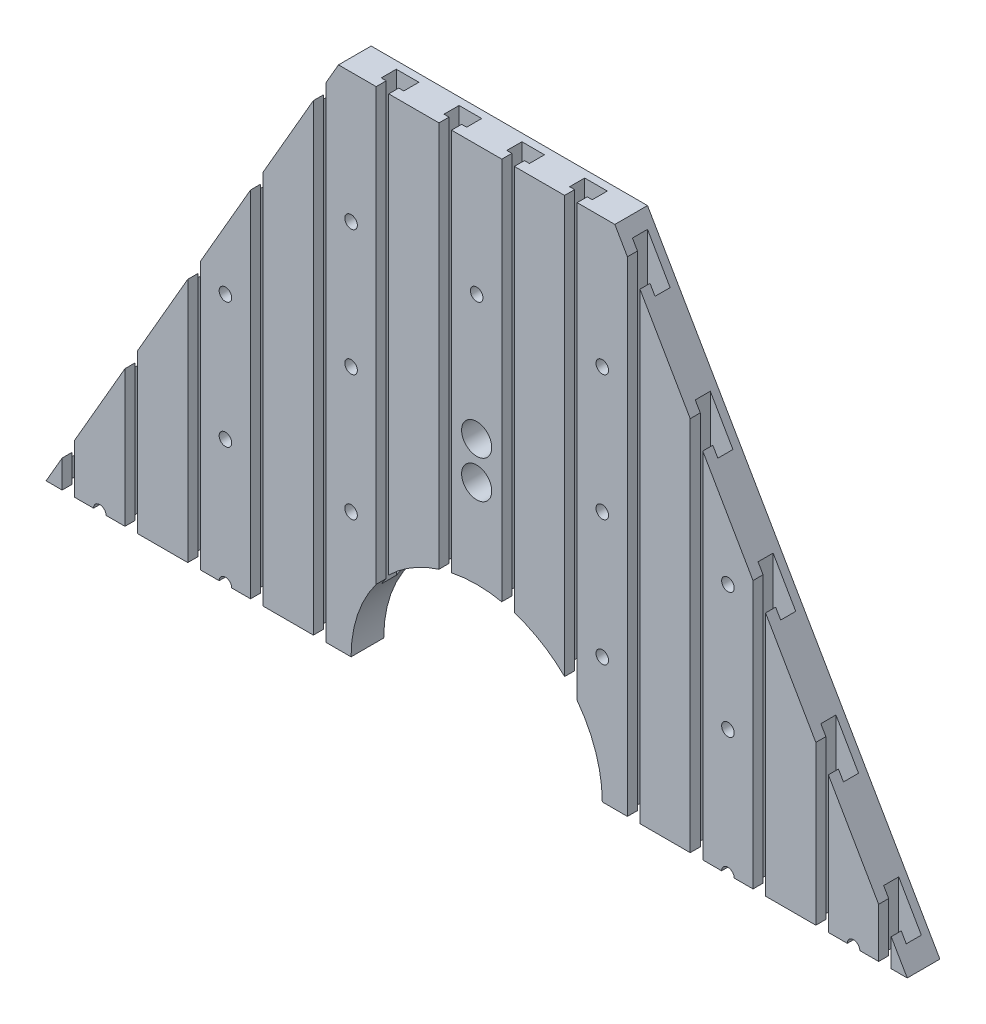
SolidWorks part; units mm, degrees
ref_plane "Plan de face" through (0, 0, 0) normal (0, 0, 1) x (1, 0, 0)
ref_plane "Plan de dessus" through (0, 0, 0) normal (0, 1, 0) x (1, 0, 0)
ref_plane "Plan de droite" through (0, 0, 0) normal (1, 0, 0) x (0, 0, -1)
sketch "Esquisse1" plane through (0, 0, 0) normal (0, 0, 1) x (1, 0, 0)
  line L6 (35.7636, 358.7862) -> (-423.8647, -437.3133) construction
  line L7 (-755.4678, -148.4209) -> (879.7592, -148.4209) construction
  line L8 (-46.1325, 376.7457) -> (415.4529, -422.7436) construction
  line L9 (257.0726, -148.4209) -> (-245.0999, 141.5085) construction
  line L10 (-257.0726, -148.4209) -> (263.2247, 151.9729) construction
  line L11 (-55, 201.5791) -> (55, 201.5791)
  line L12 (-147.0726, -148.4209) -> (147.0726, -148.4209)
  line L13 (147.0726, -148.4209) -> (202.0726, -53.1581)
  line L14 (202.0726, -53.1581) -> (55, 201.5791)
  line L15 (-147.0726, -148.4209) -> (-202.0726, -53.1581)
  line L16 (-202.0726, -53.1581) -> (-55, 201.5791)
  dimension "D1" = 60
  dimension "D2" = 60
  dimension "D3" = 110
  dimension "D4" = 350
  dimension "D5" = 60
  dimension "D6" = 60
  dimension "D7" = 110
  dimension "D8" = 110
extrude "Boss.-Extru.2" add sketch "Esquisse1" along normal blind 13
sketch "Esquisse3" plane through (0, 201.5791, 0) normal (0, 1, 0) x (1, 0, 0)
  line L0 (-12.5, 6.793) -> (-12.5, -19.2478) construction
  line L1 (-8, -3) -> (-17, -3)
  line L2 (-17, -3) -> (-17, -9)
  line L3 (-17, -9) -> (-15, -9)
  line L4 (-15, -9) -> (-15, -13)
  line L5 (55, -13) -> (-55, -13) construction
  line L6 (-10, -9) -> (-10, -13)
  line L7 (-8, -9) -> (-10, -9)
  line L8 (-8, -3) -> (-8, -9)
  line L9 (-15, -13) -> (-10, -13)
  point P2 (-12.5, -13)
  point P14 (-12.5, -3)
  dimension "D1" = 12.5
  dimension "D2" = 9
  dimension "D3" = 5
  dimension "D4" = 6
  dimension "D5" = 4
extrude "Enlèv. mat.-Extru.1" cut sketch "Esquisse3" against normal up to next
pattern_linear "Répétition linéaire1" count 8 spacing 25 along (1, 0, 0) of "Enlèv. mat.-Extru.1"
pattern_linear "Répétition linéaire2" count 7 spacing 25 along (-1, 0, 0) of "Enlèv. mat.-Extru.1"
sketch "3parties" plane through (0, 0, 0) normal (0, 0, 1) x (1, 0, 0)
  line L2 (-50, 0) -> (-171.3817, 0)
  line L3 (-165, 11.0535) -> (-202.0726, -53.1581) construction
  line L4 (50, 0) -> (171.3817, 0)
  line L5 (202.0726, -53.1581) -> (165, 11.0535) construction
  line L6 (0, -50) -> (0, -148.4209)
  line L7 (-10, -148.4209) -> (10, -148.4209) construction
  circle A0 centre (0, 0) radius 50
  dimension "D1" = 100
sketch "certcleRotules" plane through (0, 0, 13) normal (0, 0, 1) x (1, 0, 0)
  circle A0 centre (0, 0) radius 157.5
  dimension "D1" = 315
sketch "Esquisse6" plane through (0, 0, 0) normal (0, 1, 0) x (1, 0, 0)
  line L0 (-157.5, -13) -> (157.5, -13) construction
  line L1 (0, 0) -> (-4.5, 0)
  line L2 (0, 0) -> (0, -13)
  line L3 (-2.5, -9) -> (-4.5, -9)
  line L4 (-4.5, 0) -> (-4.5, -9)
  line L7 (0, -13) -> (-2.5, -13)
  line L8 (-2.5, -9) -> (-2.5, -13)
  dimension "D1" = 4.5
  dimension "D2" = 2.5
  dimension "D3" = 4
revolve "Enlèvement de matière-Révolution1" cut sketch "Esquisse6" angle 360 about L2
pattern_linear "Répétition linéaire3" count 4 spacing 50 along (0, 1, 0) count 4 spacing 50 along (1, 0, 0) of "Enlèvement de matière-Révolution1"
pattern_linear "Répétition linéaire5" count 3 spacing 50 along (0, -1, 0) count 4 spacing 50 along (1, 0, 0) of "Enlèvement de matière-Révolution1"
pattern_linear "Répétition linéaire6" count 4 spacing 50 along (0, 1, 0) count 4 spacing 50 along (-1, 0, 0) of "Enlèvement de matière-Révolution1"
pattern_linear "Répétition linéaire7" count 3 spacing 50 along (0, -1, 0) count 4 spacing 50 along (-1, 0, 0) of "Enlèvement de matière-Révolution1"
sketch "Esquisse8" plane through (0, 0, 0) normal (0, 0, -1) x (-1, 0, 0)
  circle A0 centre (0, 100) radius 4.5 construction
  circle A1 centre (0, 100) radius 4.5
extrude "bouchonBarreauHaut" add sketch "Esquisse8" against normal blind 13
sketch "Esquisse7" plane through (0, 0, 0) normal (0, 0, -1) x (-1, 0, 0)
  line L1 (-6.5, 105.15) -> (6.5, 105.15)
  line L2 (-6.5, 105.15) -> (-6.5, 80.15)
  line L3 (-6.5, 80.15) -> (6.5, 80.15)
  line L4 (6.5, 105.15) -> (6.5, 80.15)
  line L5 (0, 7.15) -> (0, -7.15) construction
  dimension "D1" = 25
  dimension "D2" = 80.15
  dimension "D3" = 13
  dimension "D4" = 6.5
extrude "Boss.-Extru.4" add sketch "Esquisse7" along normal blind 5
sketch "Esquisse9" plane through (0, 0, 0) normal (1, 0, 0) x (0, 0, -1)
  line L0 (5, 80.15) -> (0, 80.15) construction
  line L1 (5, 80.15) -> (5, 105.15) construction
  line L3 (5, 85.15) -> (5, 82.5)
  line L4 (5, 82.5) -> (-3, 82.5)
  line L6 (-3, -148.4209) -> (-3, 201.5791) construction
  line L7 (-13, 157.5) -> (-13, -157.5) construction
  line L8 (-3, 79.15) -> (-13, 79.15)
  line L9 (-3, 79.15) -> (-3, 82.5)
  line L10 (5, 85.15) -> (-13, 85.15)
  line L11 (-13, 79.15) -> (-13, 85.15)
  dimension "D1" = 5
  dimension "D2" = 2.65
  dimension "D3" = 6
revolve "Enlèvement de matière-Révolution2" cut sketch "Esquisse9" angle 360 about L10
pattern_linear "Répétition linéaire8" count 2 spacing 15 along (0, 1, 0) of "Enlèvement de matière-Révolution2"
pattern_circular "Répétition circulaire1" count 3 every 120 about axis through (0, 0, 0) along (0, 0, 1) of "Boss.-Extru.4", "Enlèvement de matière-Révolution2", "Répétition linéaire8"
sketch "Esquisse10" plane through (0, 0, 0) normal (1, 0, 0) x (0, 0, -1)
  line L0 (0, 201.5791) -> (0, -53.1581) construction
  line L1 (0, 77.5) -> (5, 77.5)
  line L2 (0, 77.5) -> (0, 72.5)
  line L3 (0, 72.5) -> (5, 72.5)
  line L4 (5, 77.5) -> (5, 72.5)
  line L5 (0, 50) -> (0, -50) construction
  line L6 (0, -72.5) -> (5, -72.5)
  line L7 (0, -72.5) -> (0, -77.5)
  line L8 (0, -77.5) -> (5, -77.5)
  line L9 (5, -72.5) -> (5, -77.5)
  line L10 (5, 80.15) -> (5, 105.15) construction
  line L11 (-9, 50) -> (0, 50) construction
  line L13 (-9, -100) -> (0, -100) construction
  point P16 (2.5, 72.5)
  point P19 (2.5, -72.5)
  dimension "D1" = 22.5
  dimension "D2" = 5
  dimension "D3" = 22.5
  dimension "D4" = 5
extrude "Boss.-Extru.6" add sketch "Esquisse10" along normal mid plane 215
chamfer "Chanfrein1" distance 5 angle 60 4 edges at (107.5, -75, -5) (-107.5, -75, -5) (-107.5, 75, -5) (107.5, 75, -5)
sketch "Esquisse11" plane through (0, 0, 13) normal (0, 0, 1) x (1, 0, 0)
  line L0 (-10, -148.4209) -> (-10, 201.5791) construction
  line L1 (-10, 23.5) -> (10, 23.5)
  line L2 (-10, 23.5) -> (-10, -23.5)
  line L3 (-10, -23.5) -> (10, -23.5)
  line L4 (10, 23.5) -> (10, -23.5)
  line L5 (10, -148.4209) -> (10, 201.5791) construction
  dimension "D1" = 47
  dimension "D2" = 23.5
extrude "Enlèv. mat.-Extru.2" cut sketch "Esquisse11" against normal blind 8.9
sketch "Esquisse13" plane through (-8, 0, 0) normal (-1, 0, 0) x (0, 0, 1)
  line L1 (4.1, -23.5) -> (11.1, -23.5)
  line L2 (4.1, -23.5) -> (4.1, -40)
  line L3 (4.1, -40) -> (6.1, -40)
  line L4 (11.1, -23.5) -> (11.1, -35)
  arc A0 (6.1, -40) -> (11.1, -35) centre (6.1, -35) ccw
  dimension "D2" = 5
  dimension "D1" = 16.5
  dimension "D3" = 7
extrude "Enlèv. mat.-Extru.3" cut sketch "Esquisse13" against normal up to surface (16 mm away)
sketch "Esquisse14" plane through (0, 0, 4.1) normal (0, 0, 1) x (1, 0, 0)
  line L0 (-8, 23.5) -> (-8, -40) construction
  line L1 (-3, -20) -> (3, -20)
  line L2 (-8, -25) -> (-8, -35)
  line L3 (-3, -40) -> (3, -40)
  line L4 (8, -25) -> (8, -35)
  line L5 (8, -40) -> (8, 23.5) construction
  line L6 (8, -40) -> (-8, -40) construction
  arc A0 (-8, -35) -> (-3, -40) centre (-3, -35) ccw
  arc A1 (3, -40) -> (8, -35) centre (3, -35) ccw
  arc A2 (3, -20) -> (8, -25) centre (3, -25) cw
  arc A3 (-3, -20) -> (-8, -25) centre (-3, -25) ccw
  point P16 (8, -20)
  point P19 (-8, -20)
  dimension "D3" = 5
  dimension "D1" = 20
extrude "Enlèv. mat.-Extru.4" cut sketch "Esquisse14" against normal up to next
mirror "Symétrie1" about plane through (0, 0, 0) normal (0, 1, 0) of "Enlèv. mat.-Extru.4", "Enlèv. mat.-Extru.3"
sketch "Esquisse15" plane through (0, 0, 0) normal (0, 0, -1) x (-1, 0, 0)
  circle A0 centre (-50, 0) radius 4.5 construction
  circle A1 centre (0, -50) radius 4.5 construction
  circle A2 centre (50, 0) radius 4.5 construction
  circle A3 centre (0, 50) radius 4.5 construction
  circle A4 centre (-50, 0) radius 4.5
  circle A5 centre (0, -50) radius 4.5
  circle A6 centre (50, 0) radius 4.5
  circle A7 centre (0, 50) radius 4.5
extrude "boucheTrousCEntre" add sketch "Esquisse15" against normal up to surface (13 mm away)
sketch "Esquisse17" plane through (0, 0, 0) normal (0, 0, -1) x (-1, 0, 0)
  line L0 (-147.0726, -148.4209) -> (-202.0726, -53.1581) construction
  line L1 (-147.0726, -148.4209) -> (-202.0726, -53.1581)
  line L3 (-202.0726, -53.1581) -> (-171.3817, 0)
  line L4 (-147.0726, -148.4209) -> (147.0726, -148.4209)
  line L5 (-171.3817, 0) -> (-50, 0)
  line L7 (50, 0) -> (171.3817, 0) construction
  line L8 (147.0726, -148.4209) -> (202.0726, -53.1581) construction
  line L9 (147.0726, -148.4209) -> (202.0726, -53.1581)
  line L10 (50, 0) -> (171.3817, 0)
  line L11 (202.0726, -53.1581) -> (171.3817, 0)
  arc A0 (50, 0) -> (-50, 0) centre (0, 0) ccw
extrude "Enlèv. mat.-Extru.5" cut sketch "Esquisse17" against normal through all contours L10 A0 L5 L3 L1 L4 L9 L11
